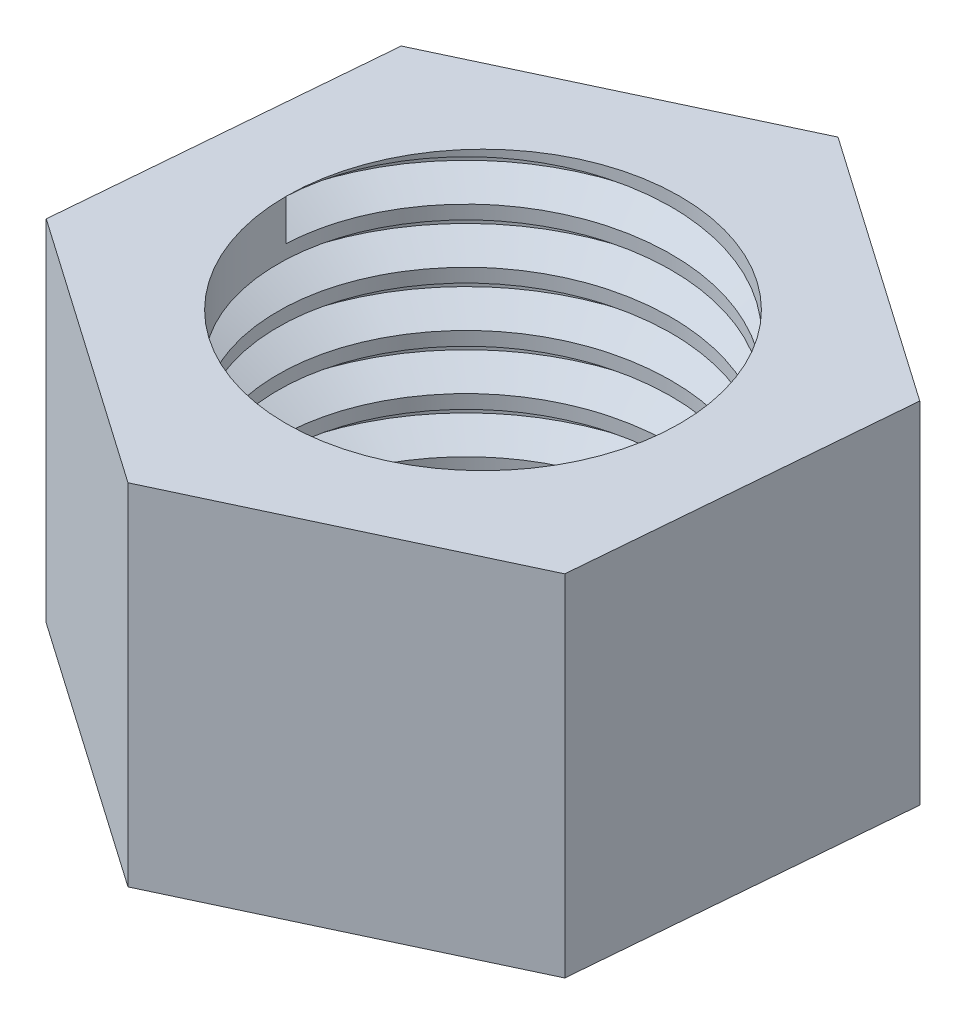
SolidWorks part; units mm, degrees
ref_plane "Front Plane" through (0, 0, 0) normal (0, 0, 1) x (1, 0, 0)
ref_plane "Top Plane" through (0, 0, 0) normal (0, 1, 0) x (1, 0, 0)
ref_plane "Right Plane" through (0, 0, 0) normal (1, 0, 0) x (0, 0, -1)
sketch "Sketch1" plane through (0, 0, 0) normal (0, 1, 0) x (1, 0, 0)
  line L0 (0, 0) -> (14.6688, 0) construction
  line L2 (6.1587, -4.29) -> (6.7946, 3.1886)
  line L3 (6.7946, 3.1886) -> (0.6359, 7.4786)
  line L4 (0.6359, 7.4786) -> (-6.1587, 4.29)
  line L5 (-6.1587, 4.29) -> (-6.7946, -3.1886)
  line L6 (-6.7946, -3.1886) -> (-0.6359, -7.4786)
  line L7 (-0.6359, -7.4786) -> (6.1587, -4.29)
  circle A1 centre (0, 0) radius 4.5
  circle A2 centre (0, 0) radius 6.5 construction
  dimension "D1" = 13
  dimension "D2" = 9
extrude "Boss-Extrude1" add sketch "Sketch1" along normal blind 8
thread "Thread1" pitch 1.25 start angle 0, offset 0, length 15, pitch 1.25, diameter 9
ref_plane "Plane1" through (-4.5, 8, 0) normal (0, 0, 1) x (-1, 0, 0)
sketch "Thread Profile1" plane through (-4.5, 8, 0) normal (0, 0, 1) x (-1, 0, 0)
  line L0 (0, 0) -> (0, 1.25) construction
  line L1 (0, 0) -> (0.6766, 0.3906)
  line L2 (0.6766, 0.3906) -> (0.6766, 0.5469)
  line L3 (0.6766, 0.5469) -> (0, 0.9375)
  line L4 (0.6766, 0.4687) -> (0, 0.4687) construction
  line L11 (0, 0) -> (0, 0.9375)
  point P2 (0, 0)
  dimension "Pitch" = 1.25
  dimension "Profile_Angle" = 60
  dimension "Profile_Land" = 0.1562
  dimension "Profile_Height" = 0.6766
